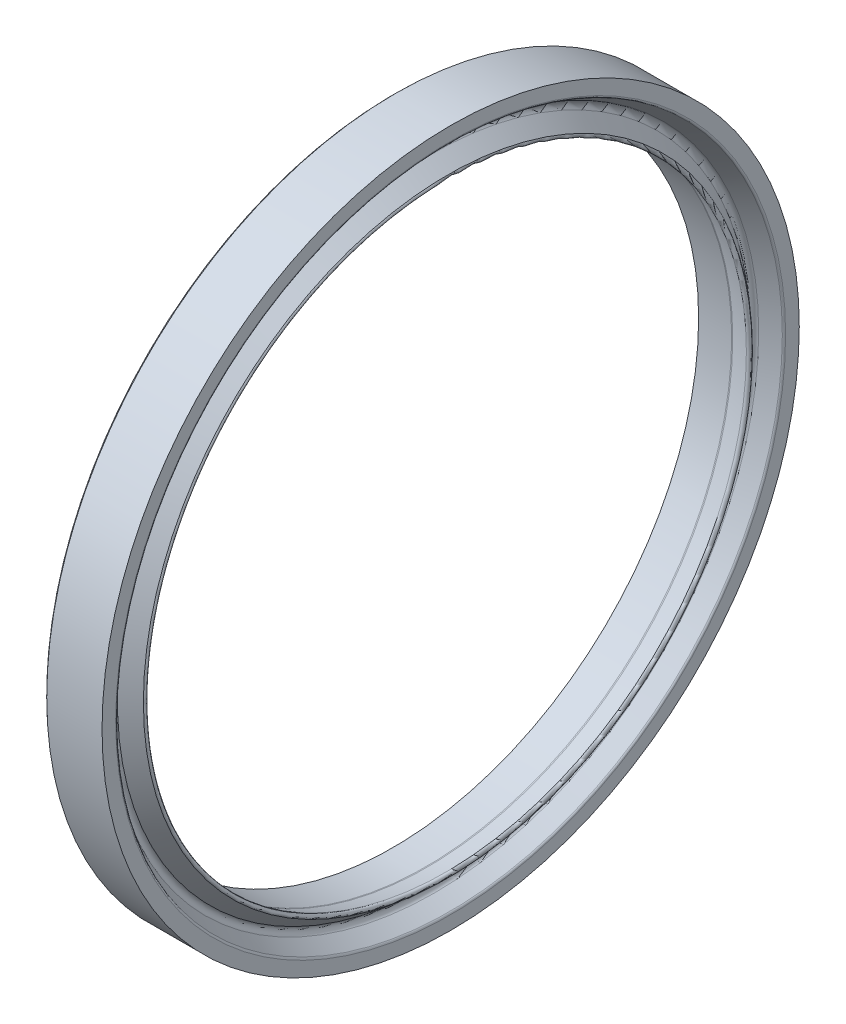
SolidWorks part; units mm, degrees
ref_plane "Plan1" through (0, 0, 0) normal (0, 0, 1) x (1, 0, 0)
ref_plane "Plan2" through (0, 0, 0) normal (0, 1, 0) x (1, 0, 0)
ref_plane "Plan3" through (0, 0, 0) normal (1, 0, 0) x (0, 0, -1)
sketch "Esquisse1" plane through (0, 0, 0) normal (0, 0, 1) x (-1, 0, 0)
  line L0 (4.6, 29) -> (4.8, 28.8)
  line L3 (0, 29) -> (4.6, 29)
  line L4 (0, 29) -> (0, 27.8632)
  line L5 (0.1, 27.69) -> (1.3459, 26.9707)
  line L6 (4.8, 28.8) -> (4.8, 25.4287)
  line L7 (1.403, 26.3179) -> (0.2275, 25.3315)
  line L8 (0, 0) -> (0, 29) construction
  line L9 (-2.434, 0) -> (3.3798, 0) construction
  line L10 (4.8, 25.4287) -> (2.0527, 25.4287)
  line L11 (1.9491, 25.4151) -> (0.4, 25)
  arc A0 (2.0527, 25.4287) -> (1.9491, 25.4151) centre (2.0527, 25.0287) ccw
  arc A1 (1.3459, 26.9707) -> (1.403, 26.3179) centre (1.1459, 26.6243) cw
  arc A2 (0.1, 27.69) -> (0, 27.8632) centre (0.2, 27.8632) cw
  arc A4 (0.2275, 25.3315) -> (0.4, 25) centre (0.3505, 25.1849) ccw
  point P10 (2, 25.4287)
  point P13 (1.8406, 26.685)
  point P20 (1.8406, 26.685)
  point P24 (0, 27.7477)
  dimension "D5" = 70
  dimension "D6" = 25
  dimension "D10" = 0.4
  dimension "D11" = 0.2
  dimension "D8" = 1.685
  dimension "D3" = 0.4
  dimension "D1" = 45
  dimension "Diamètre extérieur" = 29
  dimension "D2" = 0.2
  dimension "Epaisseur" = 4.8
  dimension "D4" = 120
  dimension "D7" = 2
  dimension "D9" = 1.8406
  dimension "Diamètre nominal" = 25
revolve "Base-Révolution" add sketch "Esquisse1" angle 360 about L9
